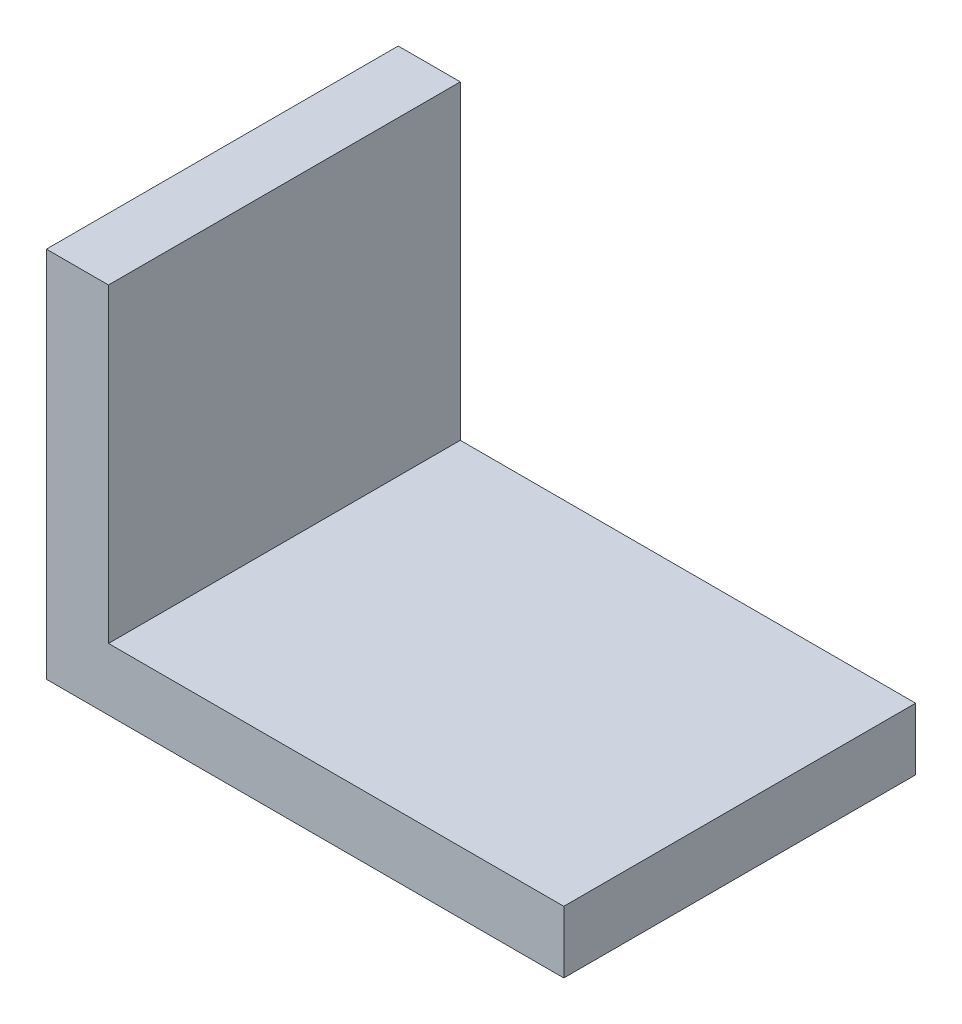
SolidWorks part; units mm, degrees
ref_plane "Front" through (0, 0, 0) normal (0, 0, 1) x (1, 0, 0)
ref_plane "Top" through (0, 0, 0) normal (0, 1, 0) x (1, 0, 0)
ref_plane "Right" through (0, 0, 0) normal (1, 0, 0) x (0, 0, -1)
sketch "Sketch1" plane through (0, 0, 0) normal (0, 0, 1) x (1, 0, 0)
  line L0 (0, 0) -> (0, 90)
  line L1 (0, 90) -> (15, 90)
  line L2 (15, 90) -> (15, 15)
  line L3 (15, 15) -> (125, 15)
  line L4 (125, 15) -> (125, 0)
  line L5 (125, 0) -> (0, 0)
  dimension "D1" = 125
  dimension "D3" = 15
  dimension "D4" = 90
extrude "Extrude1" add sketch "Sketch1" along normal mid plane 85
sketch "Sketch2" plane through (0, 0, 0) normal (0, 0, 1) x (1, 0, 0)
  line L0 (15, 62.2031) -> (91.1032, 62.2031)
  line L1 (15, 15) -> (15, 90) construction
  line L2 (91.1032, 62.2031) -> (91.1032, 15)
  line L3 (125, 15) -> (15, 15) construction
